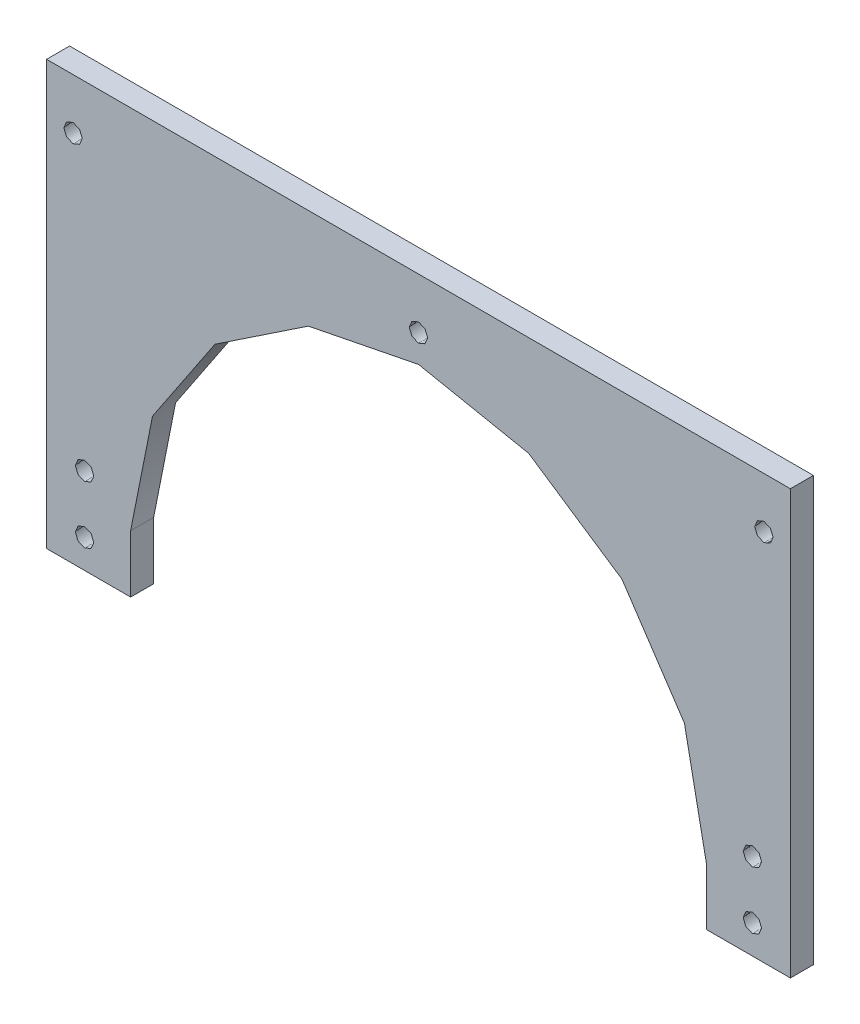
SolidWorks part; units mm, degrees
ref_plane "Plan de face" through (0, 0, 0) normal (0, 0, 1) x (1, 0, 0)
ref_plane "Plan de dessus" through (0, 0, 0) normal (0, 1, 0) x (1, 0, 0)
ref_plane "Plan de droite" through (0, 0, 0) normal (1, 0, 0) x (0, 0, -1)
sketch "Esquisse1" plane through (0, 0, 0) normal (0, 0, 1) x (1, 0, 0)
  line L0 (0, 162) -> (323, 162) construction
  line L1 (0, 0) -> (36.5, 0)
  line L2 (0, 0) -> (0, 184)
  line L3 (0, 184) -> (323, 184)
  line L4 (323, 0) -> (323, 184)
  line L5 (0, 25) -> (323, 25) construction
  line L6 (36.5, 25) -> (36.5, 0)
  line L7 (286.5, 25) -> (286.5, 0)
  line L8 (286.5, 0) -> (323, 0)
  line L9 (16.5, 37.5) -> (306.5, 37.5) construction
  line L10 (16.5, 37.5) -> (16.5, 12.5) construction
  line L11 (16.5, 12.5) -> (306.5, 12.5) construction
  line L12 (306.5, 37.5) -> (306.5, 12.5) construction
  line L13 (16.5, 37.5) -> (306.5, 12.5) construction
  line L14 (16.5, 12.5) -> (306.5, 37.5) construction
  circle A0 centre (16.5, 37.5) radius 4
  circle A1 centre (161.5, 162) radius 4
  circle A2 centre (311.5, 162) radius 4
  circle A3 centre (11.5, 162) radius 4
  arc A4 (286.5, 25) -> (36.5, 25) centre (161.5, 25) ccw
  circle A5 centre (16.5, 12.5) radius 4
  circle A6 centre (306.5, 12.5) radius 4
  circle A7 centre (306.5, 37.5) radius 4
  dimension "D3" = 125
  dimension "D5" = 8
  dimension "D6" = 150
  dimension "D7" = 150
  dimension "D11" = 8
  dimension "D1" = 184
  dimension "D2" = 323
  dimension "D4" = 22
  dimension "D8" = 25
  dimension "D9" = 25
  dimension "D10" = 290
extrude "Boss.-Extru.1" add sketch "Esquisse1" along normal blind 10
